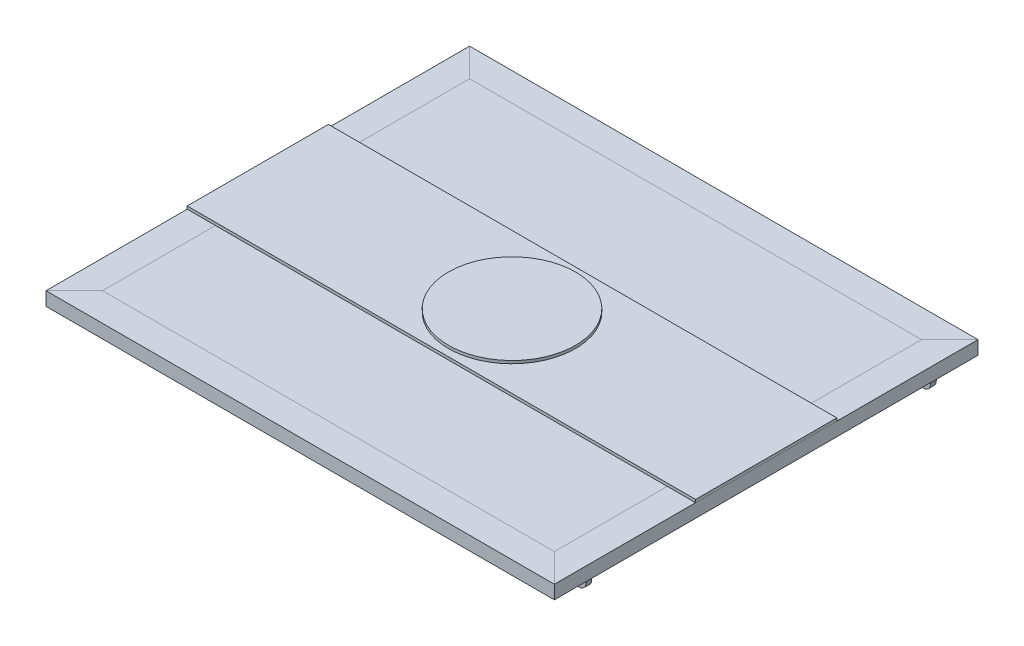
SolidWorks part; units mm, degrees
ref_plane "前视基准面" through (0, 0, 0) normal (0, 0, 1) x (1, 0, 0)
ref_plane "上视基准面" through (0, 0, 0) normal (0, 1, 0) x (1, 0, 0)
ref_plane "右视基准面" through (0, 0, 0) normal (1, 0, 0) x (0, 0, -1)
sketch "草图1" plane through (0, 0, 0) normal (0, 1, 0) x (1, 0, 0)
  line L0 (-200, 650) -> (-200, -650)
  line L1 (-800, -650) -> (800, -650)
  line L2 (-800, -650) -> (-800, 650)
  line L3 (-800, 650) -> (800, 650)
  line L4 (800, -650) -> (800, 650)
  line L5 (-800, -650) -> (800, 650) construction
  line L6 (-800, 650) -> (800, -650) construction
  line L7 (200, 650) -> (200, -650)
  line L8 (0, 0) -> (0, 815.0101) construction
  point P0 (0, 0)
  dimension "D1" = 1600
  dimension "D2" = 1300
  dimension "D3" = 400
other "槽钢 10(1)"
ref_plane "基准面1" through (-800, 0, 650) normal (0, 0, -1) x (0, 1, 0)
sketch "Sketch11" plane through (-800, 0, 650) normal (0, 0, -1) x (0, 1, 0)
  line L0 (0, 0) -> (0, -100)
  line L1 (0, -100) -> (-48, -100)
  line L2 (0, -50) -> (-5.3, -50) construction
  line L3 (-5.3, -82.1991) -> (-5.3, -17.8009)
  line L4 (-13.1549, -90.6746) -> (-44.0725, -93.0278)
  line L5 (-48, -97.2655) -> (-48, -100)
  line L6 (-5.3, -90.0767) -> (-5.3, -93.3267) construction
  line L7 (-5.3, -93.3267) -> (-48, -93.3267) construction
  line L8 (-24, -100) -> (-24, -91.5) construction
  line L9 (-48, -2.7345) -> (-48, 0)
  line L10 (0, 0) -> (-48, 0)
  line L11 (-13.1549, -9.3254) -> (-44.0725, -6.9722)
  arc A0 (-5.3, -82.1991) -> (-13.1549, -90.6746) centre (-13.8, -82.1991) cw
  arc A1 (-13.1549, -9.3254) -> (-5.3, -17.8009) centre (-13.8, -17.8009) cw
  arc A2 (-44.0725, -93.0278) -> (-48, -97.2655) centre (-43.75, -97.2655) ccw
  arc A3 (-48, -2.7345) -> (-44.0725, -6.9722) centre (-43.75, -2.7345) ccw
  point P2 (-24, 0)
  point P17 (0, 0)
  point P20 (-5.3, -9.9233)
  point P26 (-48, -6.6733)
  point P27 (0, 0)
  dimension "r" = 8.5
  dimension "r1" = 4.25
  dimension "h" = 100
  dimension "b" = 48
  dimension "d" = 5.3
  dimension "t" = 8.5
  dimension "D5" = 42.7
  dimension "D6" = 3.25
sketch "草图4" plane through (0, -5.3, 0) normal (0, -1, 0) x (1, 0, 0)
  line L0 (0, 0) -> (1143.0401, 0) construction
  line L1 (817.8009, 667.8009) -> (817.8009, -667.8009) construction
  line L2 (817.8009, -600) -> (882.1991, -600)
  line L3 (817.8009, -600) -> (817.8009, -620)
  line L4 (817.8009, -620) -> (882.1991, -620)
  line L5 (882.1991, -600) -> (882.1991, -620)
  line L6 (882.1991, 732.1991) -> (882.1991, -732.1991) construction
  line L7 (882.1991, 600) -> (882.1991, 620)
  line L8 (817.8009, 620) -> (882.1991, 620)
  line L9 (817.8009, 600) -> (817.8009, 620)
  line L10 (817.8009, 600) -> (882.1991, 600)
  point P11 (850, -620)
  dimension "D1" = 20
  dimension "D2" = 620
extrude "凸台-拉伸1" add sketch "草图4" along normal blind 90
sketch "草图5" plane through (0, 0, -620) normal (0, 0, -1) x (-1, 0, 0)
  line L0 (-850, -95.3) -> (-850, -75.3) construction
  line L1 (-817.8009, -95.3) -> (-882.1991, -95.3) construction
  circle A0 centre (-850, -75.3) radius 10
  dimension "D1" = 20
  dimension "D2" = 20
extrude "切除-拉伸1" cut sketch "草图5" against normal through all
fillet "圆角1" radius 25 4 edges at (882.1991, -95.3, -610) (817.8009, -95.3, -610) (882.1991, -95.3, 610) (817.8009, -95.3, 610)
sketch "草图6" plane through (0, 0, 0) normal (0, 1, 0) x (1, 0, 0)
  line L0 (900, -750) -> (900, 750) construction
  line L1 (-900, -250) -> (900, -250)
  line L2 (-900, -250) -> (-900, 250)
  line L3 (-900, 250) -> (900, 250)
  line L4 (900, -250) -> (900, 250)
  line L5 (-900, -250) -> (900, 250) construction
  line L6 (-900, 250) -> (900, -250) construction
  point P0 (0, 0)
  dimension "D1" = 500
extrude "凸台-拉伸2" add sketch "草图6" along normal blind 10 separate body
sketch "草图7" plane through (0, 10, 0) normal (0, 1, 0) x (1, 0, 0)
  circle A0 centre (0, 0) radius 225
  dimension "D1" = 450
extrude "凸台-拉伸3" add sketch "草图7" along normal blind 10 separate body
sketch "草图9" plane through (0, 0, 0) normal (0, -1, 0) x (-1, 0, 0)
  line L1 (800, -650) -> (-800, -650)
  line L2 (800, -650) -> (800, 650)
  line L3 (800, 650) -> (-800, 650)
  line L4 (-800, -650) -> (-800, 650)
extrude "凸台-拉伸5" add sketch "草图9" along normal blind 48 separate body
